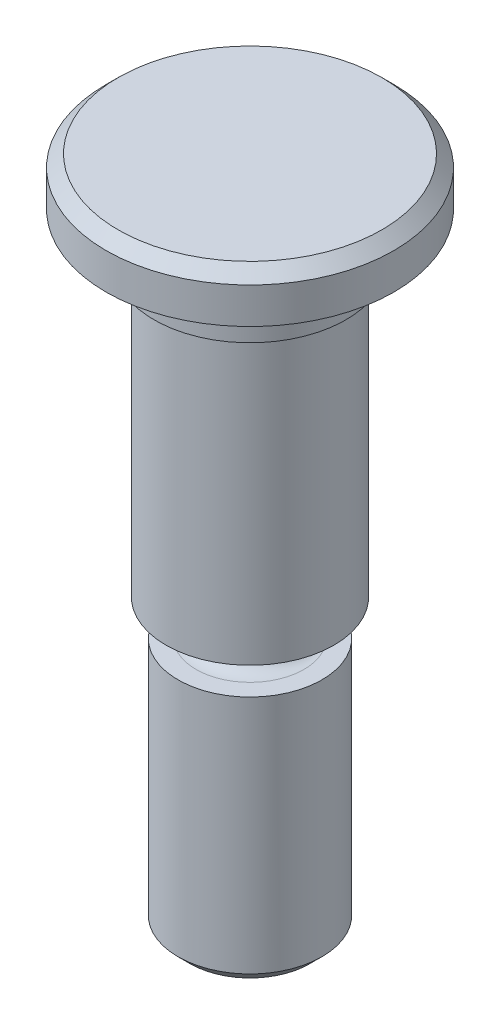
SolidWorks part; units mm, degrees
ref_plane "Plan1" through (0, 0, 0) normal (0, 0, 1) x (1, 0, 0)
ref_plane "Plan2" through (0, 0, 0) normal (0, 1, 0) x (1, 0, 0)
ref_plane "Plan3" through (0, 0, 0) normal (1, 0, 0) x (0, 0, -1)
sketch "Esquisse1" plane through (0, 0, 0) normal (0, 0, 1) x (1, 0, 0)
  line L0 (0, 0) -> (0, 28) construction
  line L1 (0, 28) -> (6, 28)
  line L2 (6, 28) -> (6, 26)
  line L3 (6, 26) -> (4, 26)
  line L4 (4, 26) -> (4, 24)
  line L5 (4, 24) -> (3.5, 24)
  line L6 (3.5, 24) -> (3.5, 12)
  line L7 (3.5, 12) -> (3, 12)
  line L8 (3, 12) -> (3, 0)
  line L9 (3, 0) -> (0, 0)
  line L10 (0, 0) -> (0, 28)
  dimension "D1" = 6
  dimension "D2" = 4
  dimension "D3" = 3.5
  dimension "D4" = 3
  dimension "D5" = 2
  dimension "D6" = 4
  dimension "D7" = 12
  dimension "D8" = 12
revolve "Base-Révolution" add sketch "Esquisse1" angle 360 about L0
chamfer "Chanfrein1" distance 0.5 angle 45
sketch "Esquisse3" plane through (0, 0, 0) normal (1, 0, 0) x (0, 0, -1)
  line L0 (2.25, 12) -> (3, 12)
  line L2 (3, 10.5) -> (2.25, 10.5)
  line L3 (3, 10.5) -> (3, 12)
  line L4 (0, 0) -> (0, 28.6907) construction
  line L5 (0, 27.5) -> (0, 28) construction
  line L6 (-3.5, 12) -> (3.5, 12) construction
  arc A0 (2.25, 12) -> (2.25, 10.5) centre (2.25, 11.25) ccw
  dimension "D2" = 1.5
  dimension "D1" = 3
  dimension "D3" = 1.5
revolve "Enlever de la matière-Révolution1" cut sketch "Esquisse3" angle 360 about L4
